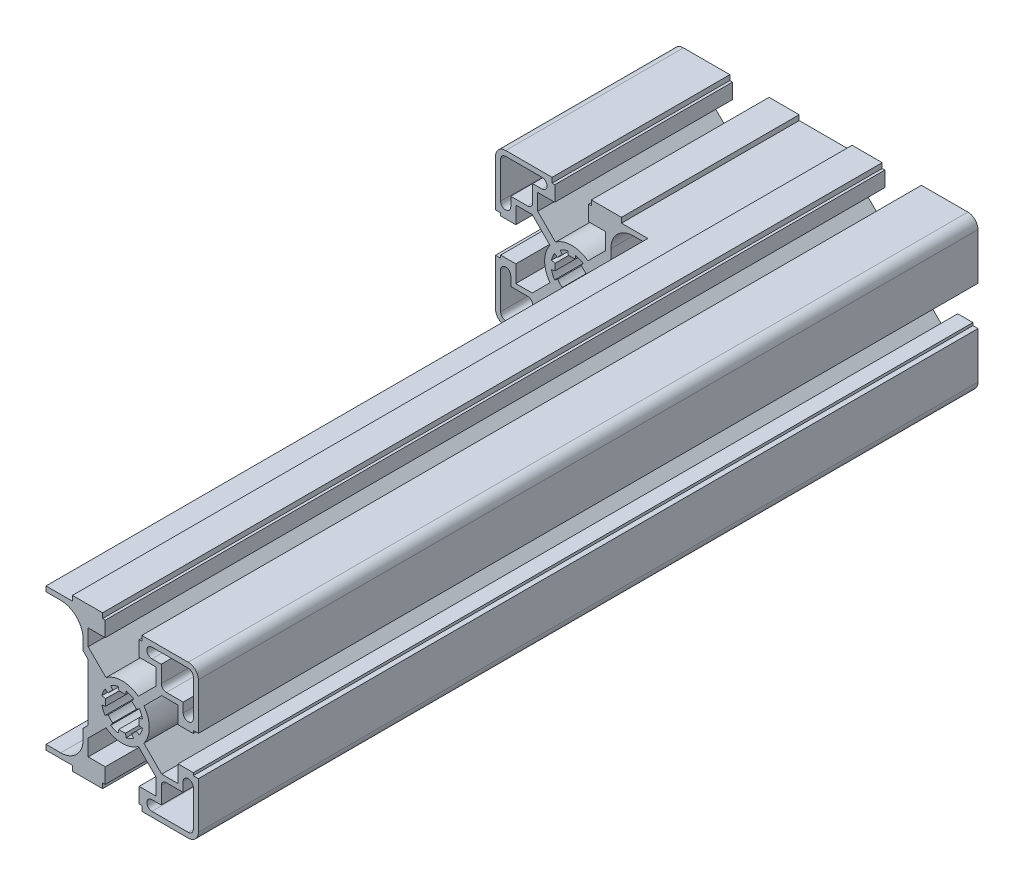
SolidWorks part; units mm, degrees
ref_plane "Front Plane" through (0, 0, 0) normal (0, 0, 1) x (1, 0, 0)
ref_plane "Top Plane" through (0, 0, 0) normal (0, 1, 0) x (1, 0, 0)
ref_plane "Right Plane" through (0, 0, 0) normal (1, 0, 0) x (0, 0, -1)
sketch "Sketch1" plane through (0, 0, 0) normal (0, 0, 1) x (1, 0, 0)
  line L0 (-27.5082, 0) -> (-17.5006, 0) construction
  line L1 (17.5006, 0) -> (27.5082, 0) construction
  line L2 (-42.0116, 22.5044) -> (-28.2956, 22.5044)
  line L3 (-28.2956, 22.5044) -> (-28.2956, 21.0058)
  line L4 (-28.2956, 21.0058) -> (-27.5082, 21.0058)
  line L5 (22.5044, -5.0038) -> (22.5044, 5.0038) construction
  line L6 (-27.5082, 21.0058) -> (-27.5082, 16.51)
  line L7 (-27.5082, 16.51) -> (-32.5501, 16.51)
  line L8 (-32.5501, 16.51) -> (-32.5501, 11.6801)
  line L9 (-32.5501, 11.6801) -> (-27.2854, 6.4154)
  line L11 (-34.1845, 10.0457) -> (-28.9198, 4.781)
  line L12 (-39.0144, 10.0457) -> (-34.1845, 10.0457)
  line L13 (-39.0144, 5.0038) -> (-39.0144, 10.0457)
  line L14 (-43.5102, 5.0038) -> (-39.0144, 5.0038)
  line L15 (-43.5102, 5.7912) -> (-43.5102, 5.0038)
  line L16 (-45.0088, 5.7912) -> (-43.5102, 5.7912)
  line L17 (-45.0088, 19.5072) -> (-45.0088, 5.7912)
  line L18 (-40.513, 11.5443) -> (-35.5473, 11.5443)
  line L19 (-40.513, 11.5443) -> (-40.513, 8.7884)
  line L20 (-34.0487, 18.0086) -> (-34.0487, 13.0429)
  line L21 (-43.5102, 19.5072) -> (-43.5102, 8.7884)
  line L23 (-34.0487, 18.0086) -> (-31.2928, 18.0086)
  line L24 (-42.0116, 21.0058) -> (-31.2928, 21.0058)
  line L25 (-21.3151, 5.9789) -> (-21.5282, 4.9077)
  line L26 (-23.6937, 5.9789) -> (-23.4806, 4.9077)
  line L27 (-17.4358, 3.3868) -> (-18.3439, 2.78)
  line L28 (-19.1176, 5.0686) -> (-19.7244, 4.1605)
  line L29 (-16.5255, -1.1893) -> (-17.5967, -0.9762)
  line L30 (-16.5255, 1.1893) -> (-17.5967, 0.9762)
  line L31 (-19.1176, -5.0686) -> (-19.7244, -4.1605)
  line L32 (-17.4358, -3.3868) -> (-18.3439, -2.78)
  line L33 (-23.6937, -5.9789) -> (-23.4806, -4.9077)
  line L34 (-21.3151, -5.9789) -> (-21.5282, -4.9077)
  line L35 (-27.573, -3.3868) -> (-26.6649, -2.78)
  line L36 (-25.8912, -5.0686) -> (-25.2844, -4.1605)
  line L37 (-28.4833, 1.1893) -> (-27.4121, 0.9762)
  line L38 (-28.4833, -1.1893) -> (-27.4121, -0.9762)
  line L39 (-25.8912, 5.0686) -> (-25.2844, 4.1605)
  line L40 (-27.573, 3.3868) -> (-26.6649, 2.78)
  line L41 (-7.8105, 22.5044) -> (-7.8105, 21.0058)
  line L42 (-7.8105, 21.0058) -> (7.8105, 21.0058)
  line L43 (-7.8105, 22.5044) -> (-16.7132, 22.5044)
  line L44 (-16.7132, 22.5044) -> (-16.7132, 21.0058)
  line L45 (-16.7132, 21.0058) -> (-17.5006, 21.0058)
  line L46 (-17.5006, 21.0058) -> (-17.5006, 16.51)
  line L47 (-17.5006, 16.51) -> (-12.4587, 16.51)
  line L48 (-12.4587, 16.51) -> (-12.4587, 11.6801)
  line L49 (-12.4587, 11.6801) -> (-17.7234, 6.4154)
  line L50 (-10.9601, 9.9099) -> (-12.4587, 8.4113)
  line L51 (7.8105, 21.0058) -> (7.8105, 22.5044)
  line L53 (-7.8105, -22.5044) -> (-16.7132, -22.5044)
  line L54 (7.8105, -22.5044) -> (16.7132, -22.5044)
  line L55 (7.8105, -21.0058) -> (7.8105, -22.5044)
  line L56 (-7.8105, -21.0058) -> (7.8105, -21.0058)
  line L57 (-7.8105, -22.5044) -> (-7.8105, -21.0058)
  line L58 (-40.513, -11.5443) -> (-35.5473, -11.5443)
  line L59 (4.3561, 19.5072) -> (-4.3561, 19.5072)
  line L60 (-10.9601, 12.9032) -> (-10.9601, 9.9099)
  line L61 (-12.4587, -8.4113) -> (-10.9601, -9.9099)
  line L62 (-12.4587, 8.4113) -> (-12.4587, -8.4113)
  line L63 (-10.9601, -12.9032) -> (-10.9601, -9.9099)
  line L64 (4.3561, -19.5072) -> (-4.3561, -19.5072)
  line L65 (10.9601, 12.9032) -> (10.9601, 9.9099)
  line L66 (10.9601, -12.9032) -> (10.9601, -9.9099)
  line L67 (12.4587, 8.4113) -> (12.4587, -8.4113)
  line L68 (10.9601, -9.9099) -> (12.4587, -8.4113)
  line L69 (10.9601, 9.9099) -> (12.4587, 8.4113)
  line L70 (-12.4587, -11.6801) -> (-17.7234, -6.4154)
  line L71 (-12.4587, -16.51) -> (-12.4587, -11.6801)
  line L72 (-17.5006, -16.51) -> (-12.4587, -16.51)
  line L73 (-17.5006, -21.0058) -> (-17.5006, -16.51)
  line L74 (-16.7132, -21.0058) -> (-17.5006, -21.0058)
  line L75 (-16.7132, -22.5044) -> (-16.7132, -21.0058)
  line L76 (-34.0487, -18.0086) -> (-31.2928, -18.0086)
  line L77 (-42.0116, -21.0058) -> (-31.2928, -21.0058)
  line L78 (-42.0116, -22.5044) -> (-28.2956, -22.5044)
  line L79 (-28.2956, -22.5044) -> (-28.2956, -21.0058)
  line L80 (-28.2956, -21.0058) -> (-27.5082, -21.0058)
  line L81 (-27.5082, -21.0058) -> (-27.5082, -16.51)
  line L82 (-27.5082, -16.51) -> (-32.5501, -16.51)
  line L83 (-32.5501, -16.51) -> (-32.5501, -11.6801)
  line L84 (-32.5501, -11.6801) -> (-27.2854, -6.4154)
  line L85 (-34.1845, -10.0457) -> (-28.9198, -4.781)
  line L86 (-43.5102, -19.5072) -> (-43.5102, -8.7884)
  line L87 (-34.0487, -18.0086) -> (-34.0487, -13.0429)
  line L88 (-40.513, -11.5443) -> (-40.513, -8.7884)
  line L89 (-45.0088, -19.5072) -> (-45.0088, -5.7912)
  line L90 (-45.0088, -5.7912) -> (-43.5102, -5.7912)
  line L91 (-43.5102, -5.7912) -> (-43.5102, -5.0038)
  line L92 (-43.5102, -5.0038) -> (-39.0144, -5.0038)
  line L93 (-39.0144, -5.0038) -> (-39.0144, -10.0457)
  line L94 (-39.0144, -10.0457) -> (-34.1845, -10.0457)
  line L96 (42.0116, 21.0058) -> (31.2928, 21.0058)
  line L97 (42.0116, 22.5044) -> (28.2956, 22.5044)
  line L98 (34.0487, 18.0086) -> (31.2928, 18.0086)
  line L99 (27.5082, 21.0058) -> (27.5082, 16.51)
  line L100 (28.2956, 21.0058) -> (27.5082, 21.0058)
  line L101 (28.2956, 22.5044) -> (28.2956, 21.0058)
  line L102 (17.5006, 21.0058) -> (17.5006, 16.51)
  line L103 (16.7132, 21.0058) -> (17.5006, 21.0058)
  line L104 (16.7132, 22.5044) -> (16.7132, 21.0058)
  line L105 (7.8105, 22.5044) -> (16.7132, 22.5044)
  line L106 (39.0144, -10.0457) -> (34.1845, -10.0457)
  line L107 (39.0144, -5.0038) -> (39.0144, -10.0457)
  line L108 (43.5102, -5.0038) -> (39.0144, -5.0038)
  line L109 (43.5102, -5.7912) -> (43.5102, -5.0038)
  line L110 (45.0088, -5.7912) -> (43.5102, -5.7912)
  line L111 (45.0088, -19.5072) -> (45.0088, -5.7912)
  line L112 (40.513, -11.5443) -> (35.5473, -11.5443)
  line L113 (40.513, -11.5443) -> (40.513, -8.7884)
  line L114 (34.0487, -18.0086) -> (34.0487, -13.0429)
  line L115 (43.5102, -19.5072) -> (43.5102, -8.7884)
  line L116 (34.1845, -10.0457) -> (28.9198, -4.781)
  line L117 (32.5501, -11.6801) -> (27.2854, -6.4154)
  line L118 (32.5501, -16.51) -> (32.5501, -11.6801)
  line L119 (27.5082, -16.51) -> (32.5501, -16.51)
  line L120 (27.5082, -21.0058) -> (27.5082, -16.51)
  line L121 (28.2956, -21.0058) -> (27.5082, -21.0058)
  line L122 (28.2956, -22.5044) -> (28.2956, -21.0058)
  line L123 (42.0116, -22.5044) -> (28.2956, -22.5044)
  line L124 (42.0116, -21.0058) -> (31.2928, -21.0058)
  line L125 (34.0487, -18.0086) -> (31.2928, -18.0086)
  line L126 (16.7132, -22.5044) -> (16.7132, -21.0058)
  line L127 (16.7132, -21.0058) -> (17.5006, -21.0058)
  line L128 (17.5006, -21.0058) -> (17.5006, -16.51)
  line L129 (17.5006, -16.51) -> (12.4587, -16.51)
  line L130 (12.4587, -16.51) -> (12.4587, -11.6801)
  line L131 (12.4587, -11.6801) -> (17.7234, -6.4154)
  line L132 (12.4587, 11.6801) -> (17.7234, 6.4154)
  line L133 (12.4587, 16.51) -> (12.4587, 11.6801)
  line L134 (27.573, 3.3868) -> (26.6649, 2.78)
  line L135 (25.8912, 5.0686) -> (25.2844, 4.1605)
  line L136 (28.4833, -1.1893) -> (27.4121, -0.9762)
  line L137 (28.4833, 1.1893) -> (27.4121, 0.9762)
  line L138 (25.8912, -5.0686) -> (25.2844, -4.1605)
  line L139 (27.573, -3.3868) -> (26.6649, -2.78)
  line L140 (21.3151, -5.9789) -> (21.5282, -4.9077)
  line L141 (23.6937, -5.9789) -> (23.4806, -4.9077)
  line L142 (17.4358, -3.3868) -> (18.3439, -2.78)
  line L143 (19.1176, -5.0686) -> (19.7244, -4.1605)
  line L144 (16.5255, 1.1893) -> (17.5967, 0.9762)
  line L145 (16.5255, -1.1893) -> (17.5967, -0.9762)
  line L146 (19.1176, 5.0686) -> (19.7244, 4.1605)
  line L147 (17.4358, 3.3868) -> (18.3439, 2.78)
  line L148 (23.6937, 5.9789) -> (23.4806, 4.9077)
  line L149 (21.3151, 5.9789) -> (21.5282, 4.9077)
  line L150 (43.5102, 19.5072) -> (43.5102, 8.7884)
  line L151 (34.0487, 18.0086) -> (34.0487, 13.0429)
  line L152 (40.513, 11.5443) -> (40.513, 8.7884)
  line L153 (40.513, 11.5443) -> (35.5473, 11.5443)
  line L154 (45.0088, 19.5072) -> (45.0088, 5.7912)
  line L155 (45.0088, 5.7912) -> (43.5102, 5.7912)
  line L156 (43.5102, 5.7912) -> (43.5102, 5.0038)
  line L157 (43.5102, 5.0038) -> (39.0144, 5.0038)
  line L158 (39.0144, 5.0038) -> (39.0144, 10.0457)
  line L159 (39.0144, 10.0457) -> (34.1845, 10.0457)
  line L160 (34.1845, 10.0457) -> (28.9198, 4.781)
  line L161 (32.5501, 11.6801) -> (27.2854, 6.4154)
  line L162 (32.5501, 16.51) -> (32.5501, 11.6801)
  line L163 (12.4587, 16.51) -> (17.5006, 16.51)
  line L164 (27.5082, 16.51) -> (32.5501, 16.51)
  arc A0 (-45.0088, 19.5072) -> (-42.0116, 22.5044) centre (-42.0116, 19.5072) cw
  arc A1 (-43.5102, 8.7884) -> (-40.513, 8.7884) centre (-42.0116, 8.7884) ccw
  arc A2 (-43.5102, 19.5072) -> (-42.0116, 21.0058) centre (-42.0116, 19.5072) cw
  arc A3 (-31.2928, 21.0058) -> (-31.2928, 18.0086) centre (-31.2928, 19.5072) cw
  arc A4 (-34.0487, 13.0429) -> (-35.5473, 11.5443) centre (-35.5473, 13.0429) cw
  arc A6 (-21.5282, 4.9077) -> (-23.4806, 4.9077) centre (-22.5044, 0) ccw
  arc A7 (-27.573, 3.3868) -> (-28.4833, 1.1893) centre (-22.5044, 0) ccw
  arc A8 (-18.3439, 2.78) -> (-19.7244, 4.1605) centre (-22.5044, 0) ccw
  arc A9 (-17.5967, -0.9762) -> (-17.5967, 0.9762) centre (-22.5044, 0) ccw
  arc A10 (-19.7244, -4.1605) -> (-18.3439, -2.78) centre (-22.5044, 0) ccw
  arc A11 (-23.4806, -4.9077) -> (-21.5282, -4.9077) centre (-22.5044, 0) ccw
  arc A12 (-26.6649, -2.78) -> (-25.2844, -4.1605) centre (-22.5044, 0) ccw
  arc A13 (-27.4121, 0.9762) -> (-27.4121, -0.9762) centre (-22.5044, 0) ccw
  arc A14 (-25.2844, 4.1605) -> (-26.6649, 2.78) centre (-22.5044, 0) ccw
  arc A15 (-28.4833, -1.1893) -> (-27.573, -3.3868) centre (-22.5044, 0) ccw
  arc A16 (-25.8912, -5.0686) -> (-23.6937, -5.9789) centre (-22.5044, 0) ccw
  arc A17 (-21.3151, -5.9789) -> (-19.1176, -5.0686) centre (-22.5044, 0) ccw
  arc A18 (-17.4358, -3.3868) -> (-16.5255, -1.1893) centre (-22.5044, 0) ccw
  arc A19 (-16.5255, 1.1893) -> (-17.4358, 3.3868) centre (-22.5044, 0) ccw
  arc A20 (-19.1176, 5.0686) -> (-21.3151, 5.9789) centre (-22.5044, 0) ccw
  arc A21 (-23.6937, 5.9789) -> (-25.8912, 5.0686) centre (-22.5044, 0) ccw
  arc A22 (-34.0487, -13.0429) -> (-35.5473, -11.5443) centre (-35.5473, -13.0429) ccw
  arc A23 (-4.3561, 19.5072) -> (-10.9601, 12.9032) centre (-4.3561, 12.9032) ccw
  arc A24 (-4.3561, -19.5072) -> (-10.9601, -12.9032) centre (-4.3561, -12.9032) cw
  arc A25 (4.3561, 19.5072) -> (10.9601, 12.9032) centre (4.3561, 12.9032) cw
  arc A26 (4.3561, -19.5072) -> (10.9601, -12.9032) centre (4.3561, -12.9032) ccw
  arc A27 (-31.2928, -21.0058) -> (-31.2928, -18.0086) centre (-31.2928, -19.5072) ccw
  arc A28 (-43.5102, -19.5072) -> (-42.0116, -21.0058) centre (-42.0116, -19.5072) ccw
  arc A29 (-45.0088, -19.5072) -> (-42.0116, -22.5044) centre (-42.0116, -19.5072) ccw
  arc A30 (-43.5102, -8.7884) -> (-40.513, -8.7884) centre (-42.0116, -8.7884) cw
  arc A31 (-17.7234, 6.4154) -> (-27.2854, 6.4154) centre (-22.5044, 0) ccw
  arc A32 (-27.2854, -6.4154) -> (-17.7234, -6.4154) centre (-22.5044, 0) ccw
  arc A33 (-28.9198, 4.781) -> (-28.9198, -4.781) centre (-22.5044, 0) ccw
  arc A34 (45.0088, 19.5072) -> (42.0116, 22.5044) centre (42.0116, 19.5072) ccw
  arc A35 (43.5102, 19.5072) -> (42.0116, 21.0058) centre (42.0116, 19.5072) ccw
  arc A36 (31.2928, 21.0058) -> (31.2928, 18.0086) centre (31.2928, 19.5072) ccw
  arc A37 (28.9198, 4.781) -> (28.9198, -4.781) centre (22.5044, 0) cw
  arc A38 (27.2854, -6.4154) -> (17.7234, -6.4154) centre (22.5044, 0) cw
  arc A39 (17.7234, 6.4154) -> (27.2854, 6.4154) centre (22.5044, 0) cw
  arc A40 (43.5102, -8.7884) -> (40.513, -8.7884) centre (42.0116, -8.7884) ccw
  arc A41 (34.0487, -13.0429) -> (35.5473, -11.5443) centre (35.5473, -13.0429) cw
  arc A42 (45.0088, -19.5072) -> (42.0116, -22.5044) centre (42.0116, -19.5072) cw
  arc A43 (43.5102, -19.5072) -> (42.0116, -21.0058) centre (42.0116, -19.5072) cw
  arc A44 (31.2928, -21.0058) -> (31.2928, -18.0086) centre (31.2928, -19.5072) cw
  arc A45 (23.6937, 5.9789) -> (25.8912, 5.0686) centre (22.5044, 0) cw
  arc A46 (19.1176, 5.0686) -> (21.3151, 5.9789) centre (22.5044, 0) cw
  arc A47 (16.5255, 1.1893) -> (17.4358, 3.3868) centre (22.5044, 0) cw
  arc A48 (17.4358, -3.3868) -> (16.5255, -1.1893) centre (22.5044, 0) cw
  arc A49 (21.3151, -5.9789) -> (19.1176, -5.0686) centre (22.5044, 0) cw
  arc A50 (25.8912, -5.0686) -> (23.6937, -5.9789) centre (22.5044, 0) cw
  arc A51 (28.4833, -1.1893) -> (27.573, -3.3868) centre (22.5044, 0) cw
  arc A52 (25.2844, 4.1605) -> (26.6649, 2.78) centre (22.5044, 0) cw
  arc A53 (27.4121, 0.9762) -> (27.4121, -0.9762) centre (22.5044, 0) cw
  arc A54 (26.6649, -2.78) -> (25.2844, -4.1605) centre (22.5044, 0) cw
  arc A55 (23.4806, -4.9077) -> (21.5282, -4.9077) centre (22.5044, 0) cw
  arc A56 (19.7244, -4.1605) -> (18.3439, -2.78) centre (22.5044, 0) cw
  arc A57 (17.5967, -0.9762) -> (17.5967, 0.9762) centre (22.5044, 0) cw
  arc A58 (18.3439, 2.78) -> (19.7244, 4.1605) centre (22.5044, 0) cw
  arc A59 (27.573, 3.3868) -> (28.4833, 1.1893) centre (22.5044, 0) cw
  arc A60 (21.5282, 4.9077) -> (23.4806, 4.9077) centre (22.5044, 0) cw
  arc A62 (34.0487, 13.0429) -> (35.5473, 11.5443) centre (35.5473, 13.0429) ccw
  arc A63 (43.5102, 8.7884) -> (40.513, 8.7884) centre (42.0116, 8.7884) cw
extrude "Boss-Extrude1" add sketch "Sketch1" along normal mid plane 230.3018
sketch "Sketch2" plane through (0, 0, 115.1509) normal (0, 0, 1) x (1, 0, 0)
  line L0 (7.8105, 21.0058) -> (-7.8105, 21.0058) construction
  line L1 (-45.0088, 22.5044) -> (0, 22.5044)
  line L2 (-45.0088, 22.5044) -> (-45.0088, -22.5044)
  line L3 (-45.0088, -22.5044) -> (0, -22.5044)
  line L4 (0, 22.5044) -> (0, -22.5044)
  line L5 (-28.2956, 22.5044) -> (-42.0116, 22.5044) construction
  line L6 (-42.0116, -22.5044) -> (-28.2956, -22.5044) construction
  line L7 (-45.0088, 19.5072) -> (-45.0088, 5.7912) construction
  point P6 (0, 21.0058)
extrude "Cut-Extrude1" cut sketch "Sketch2" against normal blind 177.8
